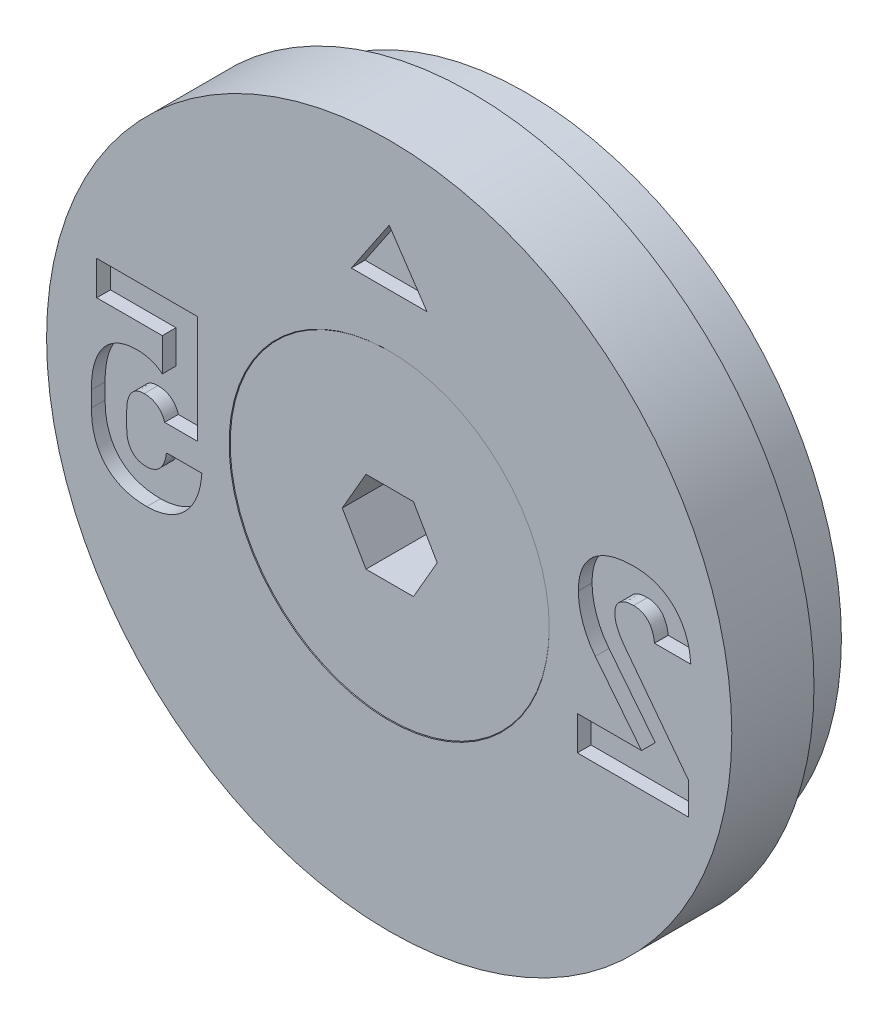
SolidWorks part; units mm, degrees
other "<M5 X .8 FHCS>-<Imported1>"
ref_plane "Front Plane" through (0, 0, 0) normal (0, 0, 1) x (1, 0, 0)
ref_plane "Top Plane" through (0, 0, 0) normal (0, 1, 0) x (1, 0, 0)
ref_plane "Right Plane" through (0, 0, 0) normal (1, 0, 0) x (0, 0, -1)
imported_body "Imported1"
sketch "Sketch1" plane through (0, 0, 0) normal (0, 0, 1) x (1, 0, 0)
  text T0 "2     5" font "Bahnschrift" height 6.858
  dimension "D1" = 3.429
  dimension "D2" = 11.43
extrude "Cut-Extrude1" cut sketch "Sketch1" against normal blind 0.5
inserted part "M5 X .8 FHCS"
move or copy body "Body-Move/Copy2" placed by mates yes
